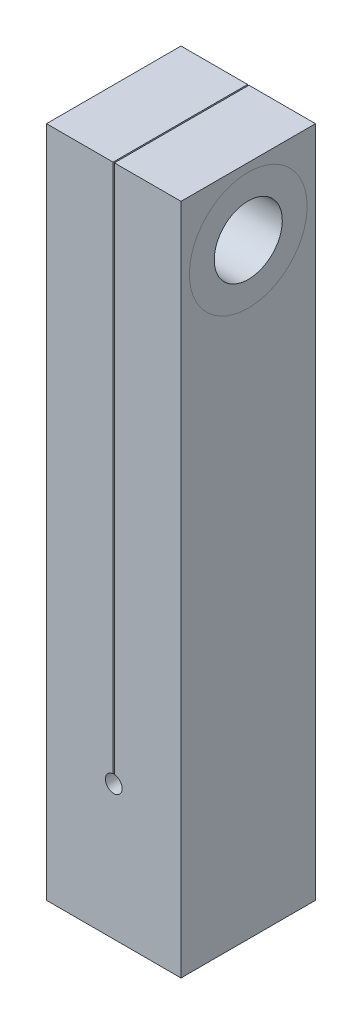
SolidWorks part; units mm, degrees
ref_plane "Front Plane" through (0, 0, 0) normal (0, 0, 1) x (1, 0, 0)
ref_plane "Top Plane" through (0, 0, 0) normal (0, 1, 0) x (1, 0, 0)
ref_plane "Right Plane" through (0, 0, 0) normal (1, 0, 0) x (0, 0, -1)
sketch "Sketch1" plane through (0, 0, 0) normal (0, 0, 1) x (1, 0, 0)
  line L0 (-0.127, 0) -> (0.127, 0)
  line L1 (0.127, 0) -> (0.127, 101.6)
  line L2 (0.127, 101.6) -> (12.7, 101.6)
  line L3 (12.7, 101.6) -> (12.7, -25.4)
  line L4 (12.7, -25.4) -> (-12.7, -25.4)
  line L5 (-12.7, -25.4) -> (-12.7, 101.6)
  line L6 (-12.7, 101.6) -> (-0.127, 101.6)
  line L7 (-0.127, 101.6) -> (-0.127, 0)
  point P4 (0, 0)
  dimension "D1" = 25.4
  dimension "D2" = 101.6
  dimension "D3" = 25.4
  dimension "D4" = 0.254
extrude "Boss-Extrude1" add sketch "Sketch1" along normal mid plane 25.4
sketch "Sketch2" plane through (12.7, 0, 0) normal (1, 0, 0) x (0, 0, -1)
  line L0 (0, 101.6) -> (0, 88.9) construction
  line L1 (-12.7, 101.6) -> (12.7, 101.6) construction
  circle A0 centre (0, 88.9) radius 6.4262
  dimension "D1" = 12.8524
  dimension "D2" = 12.7
extrude "Cut-Extrude1" cut sketch "Sketch2" against normal through all
sketch "Sketch4" plane through (0, 0, 12.7) normal (0, 0, 1) x (1, 0, 0)
  line L0 (0.127, 0) -> (-0.127, 0) construction
  circle A0 centre (0, 0) radius 1.5875
  dimension "D1" = 3.175
extrude "Cut-Extrude2" cut sketch "Sketch4" against normal through all
sketch "Sketch3" plane through (12.7, 0, 0) normal (1, 0, 0) x (0, 0, -1)
  circle A0 centre (0, 88.9) radius 11.1125
  dimension "D1" = 22.225
